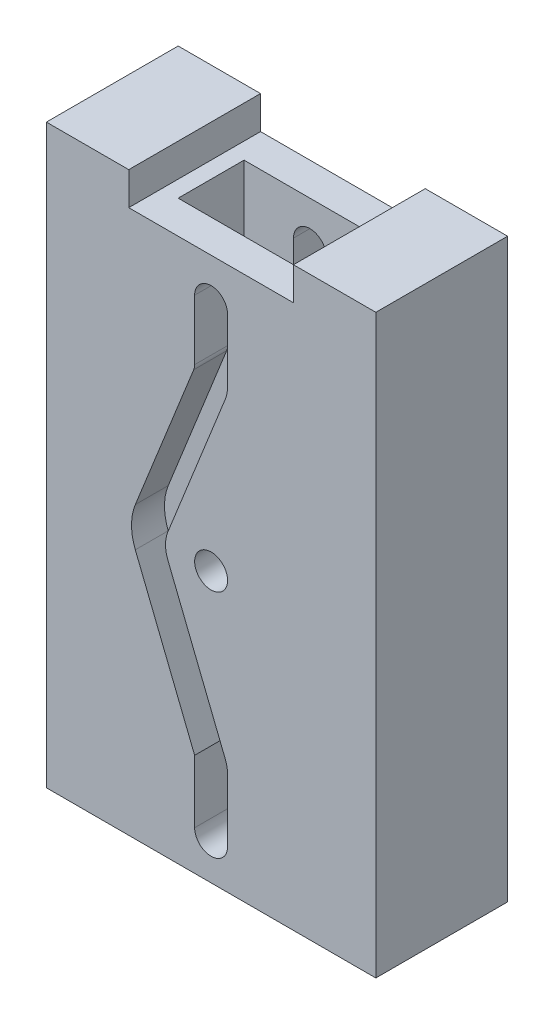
SolidWorks part; units mm, degrees
ref_plane "Face" through (0, 0, 0) normal (0, 0, 1) x (1, 0, 0)
ref_plane "Dessus" through (0, 0, 0) normal (0, 1, 0) x (1, 0, 0)
ref_plane "Droite" through (0, 0, 0) normal (1, 0, 0) x (0, 0, -1)
sketch "Esquisse1" plane through (0, 0, 0) normal (0, 0, 1) x (1, 0, 0)
  line L0 (0, 0) -> (0, 88.2106) construction
  line L1 (0, 0) -> (50, 0)
  line L4 (50, 0) -> (50, 175)
  line L5 (50, 175) -> (-50, 175)
  line L6 (-50, 175) -> (-50, 0)
  line L11 (-50, 0) -> (0, 0)
  dimension "D1" = 100
  dimension "D2" = 175
extrude "Base-Extrusion" add sketch "Esquisse1" along normal blind 40
sketch "Esquisse2" plane through (0, 175, 0) normal (0, 1, 0) x (-1, 0, 0)
  line L0 (0, 0) -> (0, 47.6984) construction
  line L1 (-50, 0) -> (50, 0) construction
  line L2 (-25, 0) -> (25, 0)
  line L3 (-25, 0) -> (-25, 40)
  line L4 (-25, 40) -> (25, 40)
  line L5 (25, 0) -> (25, 40)
  line L6 (-50, 40) -> (50, 40) construction
  dimension "D1" = 50
extrude "Enlèv. mat.-Extru.1" cut sketch "Esquisse2" against normal blind 10
sketch "Esquisse10" plane through (-50, 0, 0) normal (-1, 0, 0) x (0, 0, 1)
  line L0 (40, 0) -> (0, 0) construction
  line L1 (10, 130) -> (30, 130)
  line L2 (10, 130) -> (10, 10)
  line L3 (10, 10) -> (30, 10)
  line L4 (30, 130) -> (30, 10)
  line L5 (20, 0) -> (20, 175) construction
  line L7 (40, 175) -> (0, 175) construction
  dimension "D1" = 10
  dimension "D2" = 20
  dimension "D3" = 120
extrude "Enlèv. mat.-Extru.6" cut sketch "Esquisse10" against normal blind 70
sketch "Esquisse5" plane through (0, 175, 0) normal (0, 1, 0) x (-1, 0, 0)
  line L1 (-20, 10) -> (20, 10)
  line L2 (-20, 10) -> (-20, 30)
  line L3 (-20, 30) -> (20, 30)
  line L4 (20, 10) -> (20, 30)
  line L5 (0, 0) -> (0, 40.7143) construction
  line L6 (-20, 30) -> (-20, 10) construction
  line L7 (50, 20) -> (-41.3296, 20) construction
  line L8 (50, 40) -> (50, 0) construction
  line L9 (-20, 10) -> (50, 10) construction
extrude "Enlèv. mat.-Extru.3" cut sketch "Esquisse5" against normal through all
sketch "Esquisse6" plane through (0, 0, 40) normal (0, 0, 1) x (1, 0, 0)
  line L0 (0, 165) -> (0, -14.2508) construction
  line L1 (-25, 165) -> (25, 165) construction
  line L2 (50, 175) -> (25, 175) construction
  line L3 (-10.1032, 32) -> (12.4429, 32) construction
  line L4 (-5, 152) -> (-5, 133.7332)
  line L5 (-12.6556, 132) -> (12.4429, 132) construction
  line L6 (5, 152) -> (5, 132.9629)
  line L7 (0, 32) -> (-20, 82) construction
  line L8 (0, 132) -> (-20, 82) construction
  line L9 (-5.2861, 132.2477) -> (-23.0083, 87.9423)
  line L10 (4.2848, 129.249) -> (-13.1293, 85.7139)
  line L11 (-13.1293, 78.2861) -> (4.2848, 34.751)
  line L12 (-23.0083, 76.0577) -> (-5, 31.0371)
  line L13 (5, 31.0371) -> (5, 12)
  line L14 (-5, 31.0371) -> (-5, 12)
  arc A0 (-5, 152) -> (5, 152) centre (0, 152) cw
  arc A1 (-5, 12) -> (5, 12) centre (0, 12) ccw
  arc A2 (-13.1293, 85.7139) -> (-13.1293, 78.2861) centre (-3.8445, 82) ccw
  arc A3 (-23.0083, 87.9423) -> (-23.0083, 76.0577) centre (-8.1526, 82) ccw
  arc A4 (-5, 133.7332) -> (-5.2861, 132.2477) centre (-9, 133.7332) cw
  arc A5 (5, 132.9629) -> (4.2848, 129.249) centre (-5, 132.9629) cw
  arc A6 (5, 31.0371) -> (4.2848, 34.751) centre (-5, 31.0371) ccw
  dimension "D1" = 5
  dimension "D2" = 23
  dimension "D3" = 140
  dimension "D5" = 20
  dimension "D12" = 10
  dimension "D13" = 16
  dimension "D14" = 4
  dimension "D15" = 10
  dimension "D4" = 20
  dimension "D6" = 50
  dimension "D7" = 20
  dimension "D8" = 5
  dimension "D9" = 5
  dimension "D10" = 5
  dimension "D11" = 5
extrude "Enlèv. mat.-Extru.4" cut sketch "Esquisse6" against normal through all
sketch "Esquisse7" plane through (0, 175, 0) normal (0, 1, 0) x (-1, 0, 0)
  line L0 (-50, 0) -> (50, 40) construction
  point P4 (0, 20)
ref_plane "Plan1" through (0, 0, 20) normal (0, 0, 1) x (1, 0, 0)
sketch "Esquisse8" plane through (0, 0, 20) normal (0, 0, 1) x (1, 0, 0)
  line L0 (0, 175) -> (0, 9.6033) construction
sketch "Esquisse9" plane through (0, 0, 40) normal (0, 0, 1) x (1, 0, 0)
  line L0 (0, 82) -> (63.2272, 82) construction
  line L1 (0, 175) -> (0, 9.6033) construction
  line L2 (-3.8445, 82) -> (79.3325, 82) construction
  circle A1 centre (0, 82) radius 5
  arc A2 (-13.1293, 85.7139) -> (-13.1293, 78.2861) centre (-3.8445, 82) ccw construction
  dimension "D1" = 10
extrude "Enlèv. mat.-Extru.5" cut sketch "Esquisse9" against normal through all
